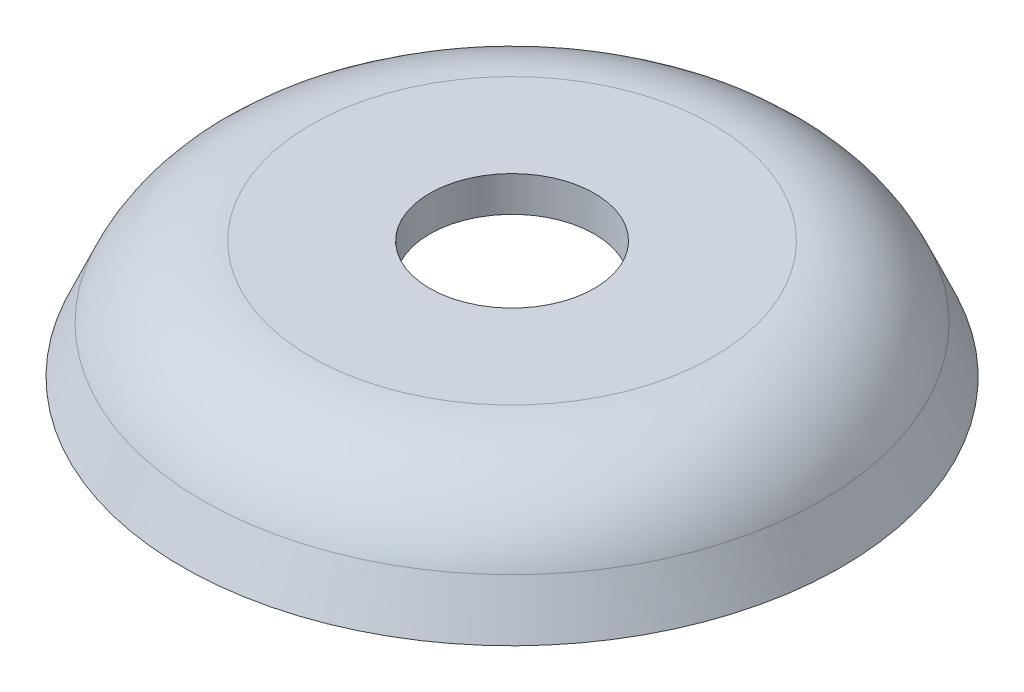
SolidWorks part; units mm, degrees
ref_plane "Front" through (0, 0, 0) normal (0, 0, 1) x (1, 0, 0)
ref_plane "Top" through (0, 0, 0) normal (0, 1, 0) x (1, 0, 0)
ref_plane "Right" through (0, 0, 0) normal (1, 0, 0) x (0, 0, -1)
sketch "Sketch1" plane through (0, 0, 0) normal (0, 0, 1) x (1, 0, 0)
  line L0 (0, 0) -> (8.5446, 0)
  line L1 (13.1272, -3.0001) -> (14, -5)
  line L2 (0, 0) -> (0, 3.7613) construction
  line L3 (0, -1.5) -> (8.5446, -1.5)
  line L4 (11.7524, -3.6001) -> (12.6252, -5.6)
  line L5 (12.6252, -5.6) -> (14, -5)
  line L6 (0, 0) -> (0, -1.5)
  arc A0 (8.5446, 0) -> (13.1272, -3.0001) centre (8.5446, -5) cw
  arc A1 (8.5446, -1.5) -> (11.7524, -3.6001) centre (8.5446, -5) cw
  dimension "D1" = 5
  dimension "D2" = 14
  dimension "D3" = 5
  dimension "D4" = 1.5
revolve "Чашка пружины" add sketch "Sketch1" angle 360 about L2
sketch "Sketch2" plane through (0, 0, 0) normal (0, 1, 0) x (1, 0, 0)
  circle A0 centre (0, 0) radius 3.5
  dimension "D1" = 7
extrude "Extrude1" cut sketch "Sketch2" against normal through all
